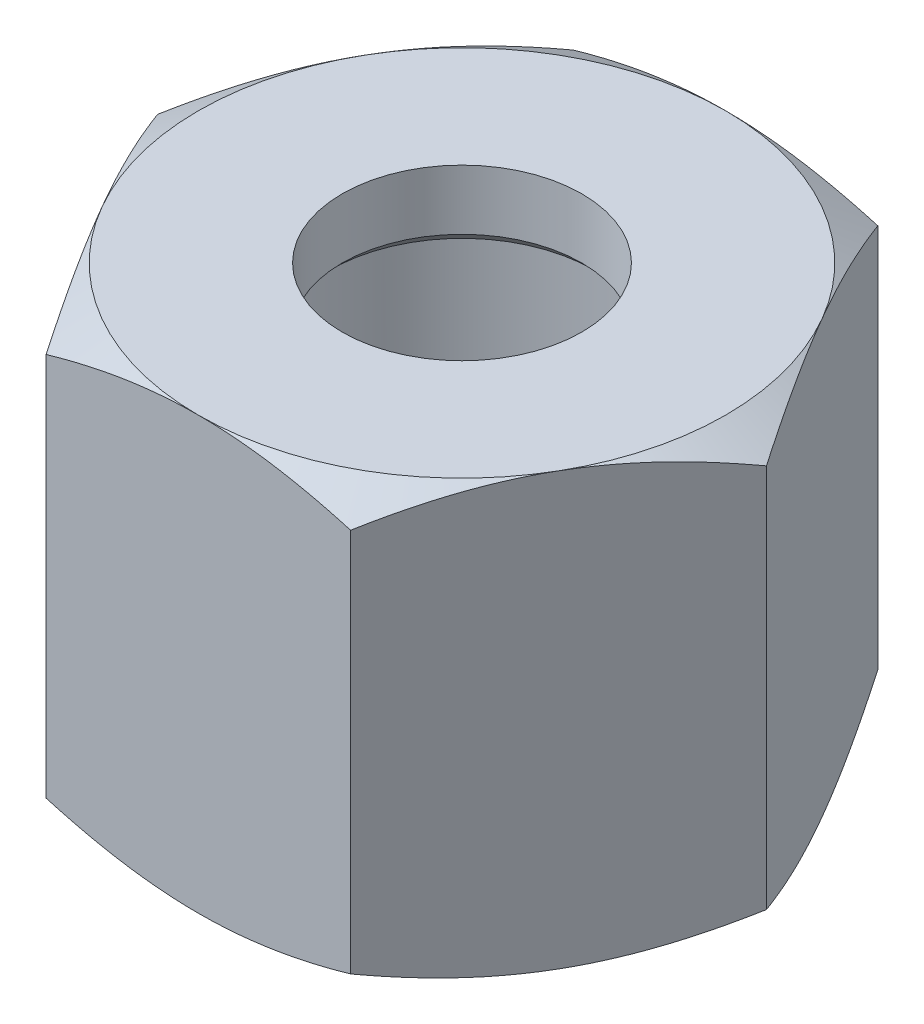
SolidWorks part; units mm, degrees
ref_plane "Přední rovina" through (0, 0, 0) normal (0, 0, 1) x (1, 0, 0)
ref_plane "Horní rovina" through (0, 0, 0) normal (0, 1, 0) x (1, 0, 0)
ref_plane "Pravá rovina" through (0, 0, 0) normal (1, 0, 0) x (0, 0, -1)
sketch "Skica1" plane through (0, 0, 0) normal (0, 1, 0) x (1, 0, 0)
  line L1 (12.7017, 0) -> (6.3509, 11)
  line L2 (6.3509, 11) -> (-6.3509, 11)
  line L3 (-6.3509, 11) -> (-12.7017, 0)
  line L4 (-12.7017, 0) -> (-6.3509, -11)
  line L5 (-6.3509, -11) -> (6.3509, -11)
  line L6 (6.3509, -11) -> (12.7017, 0)
  circle A0 centre (0, 0) radius 11 construction
extrude "Přidat vysunutím1" add sketch "Skica1" along normal blind 18
sketch "Skica2" plane through (0, 18, 0) normal (0, 1, 0) x (1, 0, 0)
  circle A0 centre (0, 0) radius 11
extrude "Odebrat vysunutím1" cut sketch "Skica2" against normal blind 1 draft 60 flip side to cut
sketch "Skica3" plane through (0, 0, 0) normal (0, -1, 0) x (1, 0, 0)
  circle A0 centre (0, 0) radius 11
extrude "Odebrat vysunutím2" cut sketch "Skica3" against normal blind 1 draft 60 flip side to cut
sketch "Skica4" plane through (0, 0, 0) normal (0, -1, 0) x (1, 0, 0)
  circle A0 centre (0, 0) radius 7.75
extrude "Odebrat vysunutím3" cut sketch "Skica4" against normal blind 15
chamfer "Zkosení2" distance 0.35 angle 45 1 edges at (0, 0, -7.75)
sketch "Skica5" plane through (0, 18, 0) normal (0, 1, 0) x (1, 0, 0)
  circle A0 centre (0, 0) radius 5
extrude "Odebrat vysunutím4" cut sketch "Skica5" against normal up to next
chamfer "Zkosení3" distance 0.5 angle 45 1 edges at (0, 15, -5)
